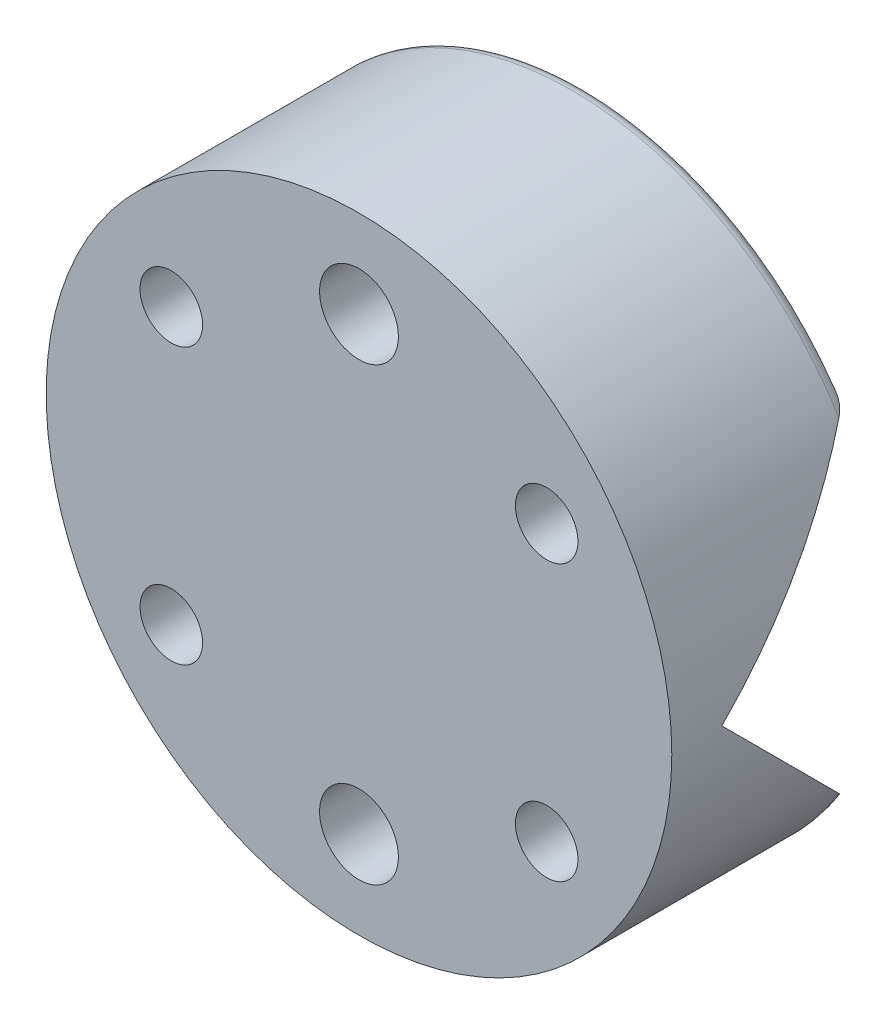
SolidWorks part; units mm, degrees
ref_plane "Plan1" through (0, 0, 0) normal (0, 0, 1) x (1, 0, 0)
ref_plane "Plan2" through (0, 0, 0) normal (0, 1, 0) x (1, 0, 0)
ref_plane "Plan3" through (0, 0, 0) normal (1, 0, 0) x (0, 0, -1)
sketch "Esquisse1" plane through (0, 0, 0) normal (0, 0, 1) x (1, 0, 0)
  circle A0 centre (0, 0) radius 25
  dimension "D1" = 50
extrude "Base-Extrusion" add sketch "Esquisse1" along normal blind 18
sketch "Esquisse4" plane through (0, 0, 0) normal (1, 0, 0) x (0, 0, -1)
  line L0 (0, 14) -> (0, -14)
  line L8 (0, 14) -> (-14, 0)
  line L9 (-14, 0) -> (0, -14)
extrude "Enlèv. mat.-Extru.4" cut sketch "Esquisse4" against normal through all
sketch "Esquisse5" plane through (0, 0, 0) normal (-1, 0, 0) x (0, 0, 1)
  line L0 (0, 14) -> (14, 0)
  line L1 (14, 0) -> (0, -14)
  line L2 (0, -14) -> (0, 14)
extrude "Enlèv. mat.-Extru.5" cut sketch "Esquisse5" against normal through all
sketch "Esquisse6" [suppressed] plane through (0, 0, 18) normal (0, 0, 1) x (1, 0, 0)
  circle A0 centre (0, 19.5) radius 3
  circle A1 centre (0, -19.5) radius 3
  dimension "D3" = 6.3
  dimension "D4" = 6.3
sketch "Esquisse10" plane through (0, 0, 18) normal (0, 0, 1) x (1, 0, 0)
  circle A0 centre (15, 11) radius 2.5
  dimension "D1" = 5
  dimension "D2" = 11
  dimension "D3" = 15
extrude "Enlèv. mat.-Extru.8" cut sketch "Esquisse10" against normal blind 10
sketch "Esquisse11" plane through (0, 0, 8) normal (0, 0, 1) x (1, 0, 0)
  circle A0 centre (15, 11) radius 2.5
  dimension "D1" = 5
extrude "Enlèv. mat.-Extru.9" cut sketch "Esquisse11" against normal blind 11 draft 60
sketch "Esquisse13" plane through (0, 0, 18) normal (0, 0, 1) x (1, 0, 0)
  circle A0 centre (15, -11) radius 2.5
  circle A1 centre (-15, 11) radius 2.5
  circle A2 centre (-15, -11) radius 2.5
  dimension "D1" = 15
  dimension "D2" = 15
  dimension "D3" = 15
  dimension "D4" = 11
  dimension "D5" = 11
  dimension "D6" = 11
extrude "Enlèv. mat.-Extru.13" cut sketch "Esquisse13" against normal blind 10
sketch "Esquisse14" plane through (0, 0, 8) normal (0, 0, 1) x (1, 0, 0)
  circle A0 centre (-15, 11) radius 2.5
extrude "Enlèv. mat.-Extru.14" cut sketch "Esquisse14" against normal blind 10 draft 60
sketch "Esquisse15" plane through (0, 0, 8) normal (0, 0, 1) x (1, 0, 0)
  circle A0 centre (-15, -11) radius 2.5
extrude "Enlèv. mat.-Extru.15" cut sketch "Esquisse15" against normal blind 10 draft 60
sketch "Esquisse17" plane through (0, 0, 8) normal (0, 0, 1) x (1, 0, 0)
  circle A0 centre (15, -11) radius 2.5
extrude "Enlèv. mat.-Extru.16" cut sketch "Esquisse17" against normal blind 10 draft 60
sketch "Esquisse18" plane through (0, 0, 18) normal (0, 0, 1) x (1, 0, 0)
  circle A0 centre (0, -18) radius 3.15
  circle A1 centre (0, 18) radius 3.15
  dimension "D1" = 18
  dimension "D2" = 18
extrude "Enlèv. mat.-Extru.17" cut sketch "Esquisse18" against normal through all
fillet "Congé1" radius 1
